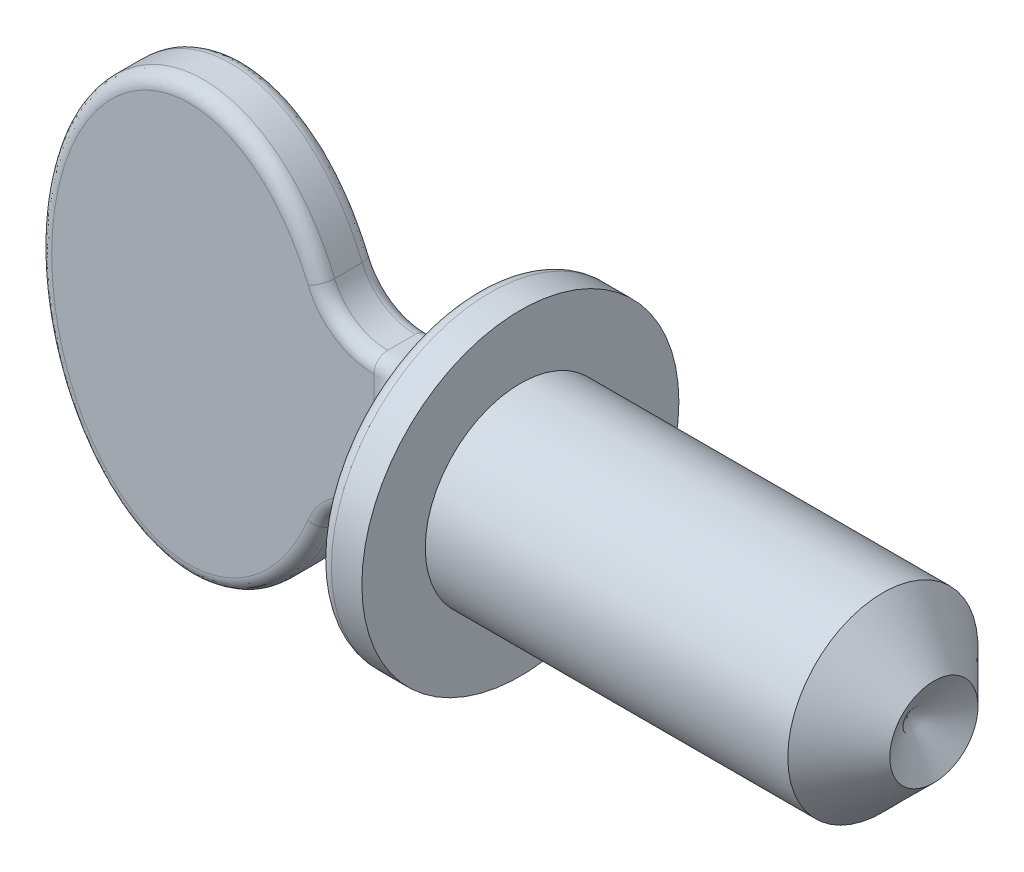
SolidWorks part; units mm, degrees
ref_plane "Front Plane" through (0, 0, 0) normal (0, 0, 1) x (1, 0, 0)
ref_plane "Top Plane" through (0, 0, 0) normal (0, 1, 0) x (1, 0, 0)
ref_plane "Right Plane" through (0, 0, 0) normal (1, 0, 0) x (0, 0, -1)
sketch "layout" plane through (0, 0, 0) normal (0, 0, 1) x (1, 0, 0)
  line L0 (0, 0) -> (13.208, 0) construction
  line L1 (5.588, 2.921) -> (5.588, -2.921)
  line L2 (3.3976, 1.3123) -> (4.8921, 1.3123) construction
  line L3 (5.588, 2.921) -> (4.7897, 2.921)
  line L4 (4.7897, 2.921) -> (4.7897, 3.2655) construction
  line L5 (4.2865, 1.706) -> (4.2865, 0)
  line L6 (4.2865, 1.706) -> (3.3355, 0.7551) construction
  line L7 (13.208, 1.7526) -> (13.208, 0)
  line L8 (3.3976, 1.3123) -> (3.3976, -1.3123)
  line L9 (13.208, 1.7526) -> (5.588, 1.7526)
  arc A0 (3.3976, 1.3123) -> (2.4197, 1.9685) centre (3.3976, 2.3692) cw
  arc A1 (4.7897, 2.921) -> (4.2865, 1.706) centre (3.0715, 2.921) cw
  arc A2 (3.3976, -1.3123) -> (2.4197, -1.9685) centre (3.3976, -2.3692) ccw
  ellipse E0 centre (0, 0) end of major axis (0, 3.937) minor radius 2.794 (2.4197, 1.9685) -> (2.4197, -1.9685) ccw
sketch "Sketch3" plane through (0, 0, 0) normal (0, 0, 1) x (1, 0, 0)
  line L0 (3.3976, 1.3123) -> (3.3976, -1.3123) construction
  line L1 (3.3976, 1.3123) -> (3.3976, -1.3123)
  arc A0 (3.3976, -1.3123) -> (2.4197, -1.9685) centre (3.3976, -2.3692) ccw construction
  arc A1 (2.4197, 1.9685) -> (3.3976, 1.3123) centre (3.3976, 2.3692) ccw construction
  arc A2 (3.3976, -1.3123) -> (2.4197, -1.9685) centre (3.3976, -2.3692) ccw
  arc A3 (2.4197, 1.9685) -> (3.3976, 1.3123) centre (3.3976, 2.3692) ccw
  ellipse E0 centre (0, 0) end of major axis (0, 3.937) minor radius 2.794 (2.4197, 1.9685) -> (2.4197, -1.9685) ccw construction
  ellipse E1 centre (0, 0) end of major axis (0, 3.937) minor radius 2.794 (2.4197, 1.9685) -> (2.4197, -1.9685) ccw
extrude "Extrude1" add sketch "Sketch3" along normal mid plane 1.016
fillet "Fillet1" radius 0.254 6 edges at (2.8088, 1.4916, -0.508) (2.8088, -1.4916, -0.508) (2.8088, 1.4916, 0.508) (2.8088, -1.4916, 0.508) (-2.794, 0, -0.508) (-2.794, 0, 0.508)
sketch "Sketch4" plane through (0, 0, 0) normal (0, 0, 1) x (1, 0, 0)
  line L0 (13.208, 1.7526) -> (13.208, 0) construction
  line L1 (13.208, 1.7526) -> (5.588, 1.7526) construction
  line L2 (5.588, 2.921) -> (5.588, -2.921) construction
  line L3 (5.588, 2.921) -> (4.7897, 2.921) construction
  line L4 (4.2865, 1.706) -> (4.2865, 0) construction
  line L5 (13.208, 0.8128) -> (13.208, 0) construction
  line L6 (12.2682, 1.7526) -> (5.588, 1.7526)
  line L7 (5.588, 2.921) -> (5.588, 1.7526)
  line L8 (5.588, 2.921) -> (4.7897, 2.921)
  line L9 (4.2865, 1.706) -> (4.2865, 0)
  line L10 (0, 0) -> (16.8942, 0) construction
  line L11 (12.7196, 0) -> (4.2865, 0)
  line L12 (12.2682, 1.7526) -> (13.208, 0.8128)
  line L13 (13.208, 0.8128) -> (12.7196, 0)
  line L14 (13.208, -0.8128) -> (12.7196, 0) construction
  line L15 (12.2682, -1.7526) -> (13.208, -0.8128) construction
  arc A0 (4.2865, 1.706) -> (4.7897, 2.921) centre (3.0715, 2.921) ccw construction
  arc A1 (4.2865, 1.706) -> (4.7897, 2.921) centre (3.0715, 2.921) ccw
revolve "Revolve1" add sketch "Sketch4" angle 360 about L10
loft "Loft1" add
fillet "Fillet2" radius 0.254 1 edges at (4.7897, 0, 2.921)
sketch "Sketch5" plane through (0, 0, 0) normal (0, 1, 0) x (1, 0, 0)
  line L0 (11.7227, 2.2981) -> (12.2682, 2.2981)
  line L1 (12.2682, 2.2981) -> (12.2682, 1.7526)
  line L2 (12.2682, 1.7526) -> (11.9954, 1.2802)
  line L3 (11.9954, 1.2802) -> (11.7227, 1.7526)
  line L4 (12.2682, -1.7526) -> (12.2682, 1.7526) construction
  line L5 (11.7227, 1.7526) -> (11.7227, 2.2981)
  line L7 (-3.6147, 0) -> (14.1406, 0) construction
  line L8 (12.2682, 1.7526) -> (5.588, 1.7526) construction
revolve "Cut-Revolve10" [suppressed] cut sketch "Sketch5" angle 360 about L7
pattern_linear "LPattern10" [suppressed] count 8 along (1, 0, 0)
equation "\"D4@layout\" = \"Head Height@layout\" / 3 * 2"
equation "\"D5@layout\" = \"Head Width@layout\" / 3"
equation "\"D6@layout\" = \"Head Width@layout\" / 2"
equation "\"D7@layout\" = \"D5@layout\" * 1.3"
equation "\"D8@layout\" = \"D4@layout\"  / 7"
equation "\"D1@Fillet1\" = \"Head Thickness@Extrude1\" / 4"
equation "\"D1@Fillet2\" = \"D1@Fillet1\""
equation "\"D1@Sketch5\" = ( \"Base Screw Dia@layout\"- \"Minor Dia@Cosmetic Thread1\" )  / 2"
equation "\"D1@LPattern10\" = int((\"Length@layout\"-\"O@Sketch4\"/2)/\"Advance@LPattern10\")"
